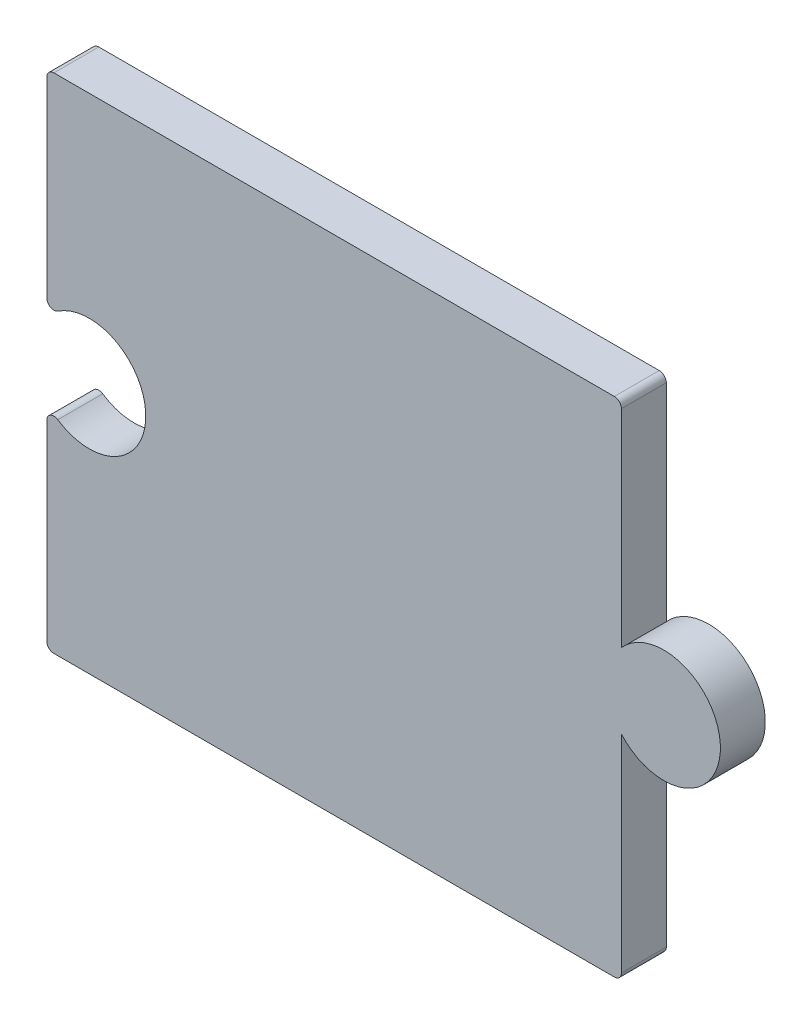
SolidWorks part; units mm, degrees
ref_plane "Front" through (0, 0, 0) normal (0, 0, 1) x (1, 0, 0)
ref_plane "Top" through (0, 0, 0) normal (0, 1, 0) x (1, 0, 0)
ref_plane "Right" through (0, 0, 0) normal (1, 0, 0) x (0, 0, -1)
sketch "Sketch1" plane through (0, 0, 0) normal (0, 0, 1) x (1, 0, 0)
  line L0 (0, 0) -> (0, 15.1342) construction
  line L1 (40.64, 35.56) -> (40.64, 20.4258)
  line L2 (40.64, 0) -> (0, 0) construction
  line L3 (0, 35.56) -> (40.64, 35.56) construction
  line L4 (0, 17.78) -> (40.64, 17.78) construction
  line L5 (20.32, 35.56) -> (20.32, 0) construction
  line L6 (0, 35.56) -> (40.64, 35.56)
  line L7 (0, 0) -> (40.64, 0)
  line L16 (0, 35.56) -> (0, 20.4258)
  line L17 (0, 20.4258) -> (0, 35.56) construction
  line L18 (0, 15.1342) -> (0, 0)
  line L21 (40.64, 15.1342) -> (40.64, 0)
  arc A0 (40.64, 15.1342) -> (40.64, 20.4258) centre (43.64, 17.78) ccw
  arc A1 (0, 15.1342) -> (0, 20.4258) centre (3, 17.78) ccw
  point P23 (3, 17.78)
  point P25 (43.64, 17.78)
  dimension "D13" = 8
  dimension "D10" = 8
  dimension "D1" = 35.56
  dimension "D3" = 40.64
  dimension "D9" = 3
  dimension "D12" = 3
extrude "Boss-Extrude1" add sketch "Sketch1" along normal blind 3.175
sketch "Sketch2" plane through (0, 0, 3.175) normal (0, 0, 1) x (1, 0, 0)
  line L0 (40.64, 35.56) -> (0, 35.56) construction
  line L1 (10.2753, 5.16) -> (35.6753, 5.16)
  line L2 (10.2753, 5.16) -> (10.2753, 30.56)
  line L3 (10.2753, 30.56) -> (35.6753, 30.56)
  line L4 (35.6753, 5.16) -> (35.6753, 30.56)
  line L5 (0, 0) -> (40.64, 0) construction
  dimension "D1" = 25.4
  dimension "D2" = 5
  dimension "D3" = 5.16
extrude "Cut-Extrude1" [suppressed] cut sketch "Sketch2" against normal blind 1
fillet "Fillet1" radius 0.5 6 edges at (0, 15.1342, 1.5875) (0, 20.4258, 1.5875) (40.64, 0, 1.5875) (0, 0, 1.5875) (40.64, 35.56, 1.5875) (0, 35.56, 1.5875)
